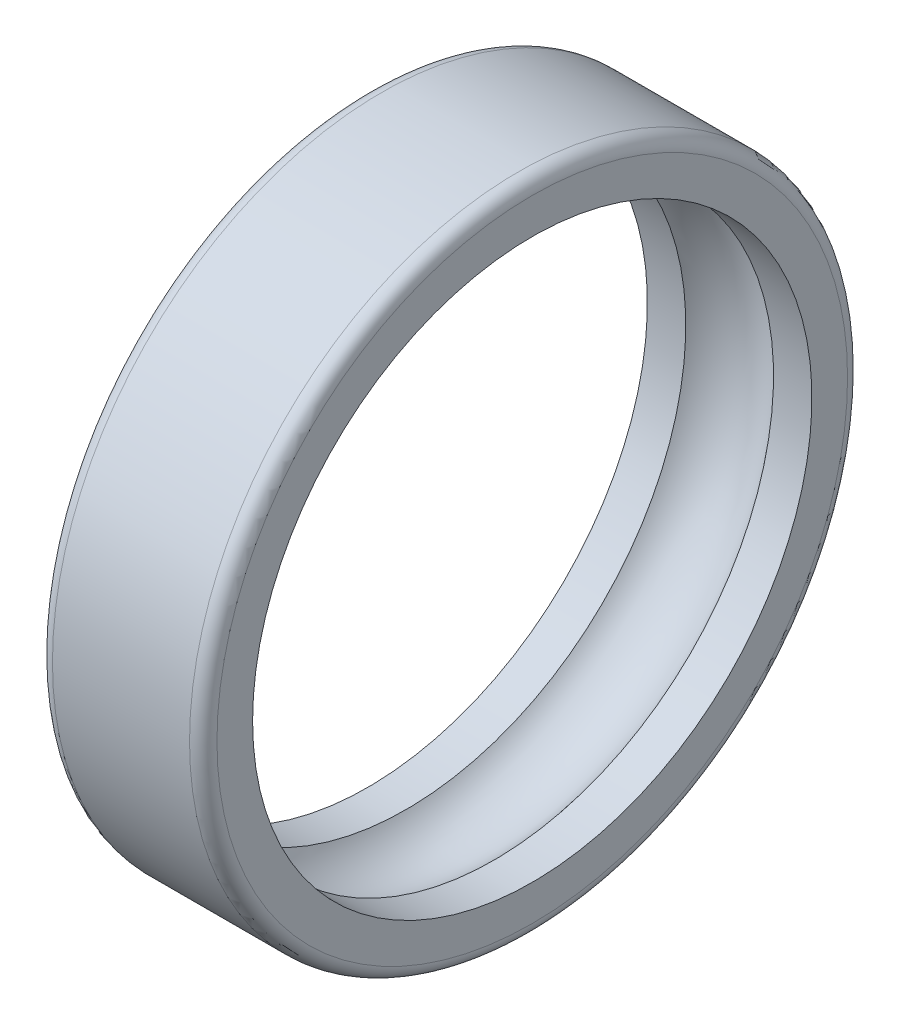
SolidWorks part; units mm, degrees
ref_plane "Face" through (0, 0, 0) normal (0, 0, 1) x (1, 0, 0)
ref_plane "Dessus" through (0, 0, 0) normal (0, 1, 0) x (1, 0, 0)
ref_plane "Droite" through (0, 0, 0) normal (1, 0, 0) x (0, 0, -1)
sketch "Esquisse1" plane through (0, 0, 0) normal (0, 0, 1) x (1, 0, 0)
  line L0 (1.6, 10.2) -> (3, 10.2)
  line L1 (-2.5, 12) -> (2.5, 12)
  line L2 (-3, 11.5) -> (-3, 10.2)
  line L3 (-3, 10.2) -> (-1.6, 10.2)
  line L4 (3, 11.5) -> (3, 10.2)
  line L5 (-4.3709, 0) -> (4.0553, 0) construction
  arc A0 (1.6, 10.2) -> (-1.6, 10.2) centre (0, 9) ccw
  arc A1 (2.5, 12) -> (3, 11.5) centre (2.5, 11.5) cw
  arc A2 (-3, 11.5) -> (-2.5, 12) centre (-2.5, 11.5) cw
  dimension "D6" = 4
  dimension "D7" = 0.5
  dimension "D8" = 0.5
  dimension "D1" = 12
  dimension "D2" = 10.2
  dimension "D3" = 3
  dimension "D4" = 6
  dimension "D5" = 9
revolve "Base-Révolution" add sketch "Esquisse1" angle 360 about L5
